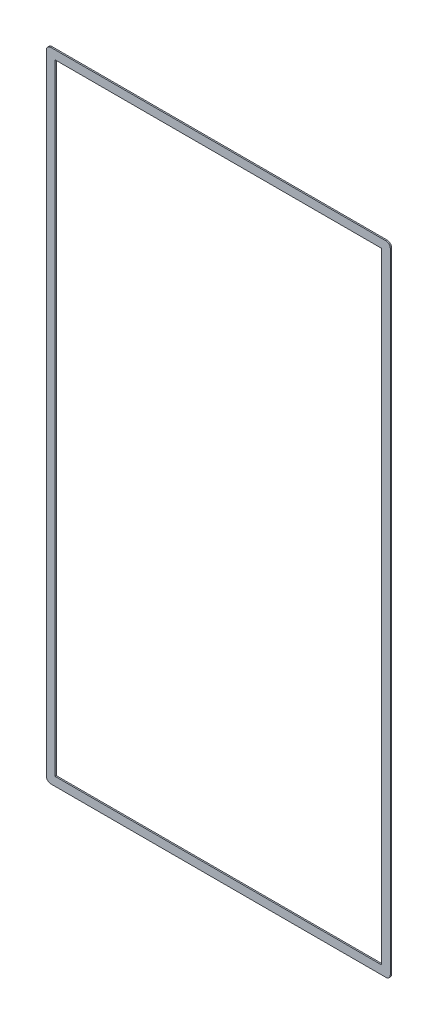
SolidWorks part; units mm, degrees
ref_plane "Front Plane" through (0, 0, 0) normal (0, 0, 1) x (1, 0, 0)
ref_plane "Top Plane" through (0, 0, 0) normal (0, 1, 0) x (1, 0, 0)
ref_plane "Right Plane" through (0, 0, 0) normal (1, 0, 0) x (0, 0, -1)
sketch "Sketch1" plane through (0, 0, 0) normal (0, 0, 1) x (1, 0, 0)
  line L0 (-251.968, 461.137) -> (-251.968, -461.137)
  line L1 (-245.618, -467.487) -> (245.618, -467.487)
  line L2 (251.968, -461.137) -> (251.968, 461.137)
  line L3 (245.618, 467.487) -> (-245.618, 467.487)
  arc A0 (-245.618, 467.487) -> (-251.968, 461.137) centre (-245.618, 461.137) ccw
  arc A1 (-251.968, -461.137) -> (-245.618, -467.487) centre (-245.618, -461.137) ccw
  arc A2 (245.618, -467.487) -> (251.968, -461.137) centre (245.618, -461.137) ccw
  arc A3 (251.968, 461.137) -> (245.618, 467.487) centre (245.618, 461.137) ccw
  point P13 (0, 467.487)
  point P14 (251.968, 0)
  dimension "D1" = 6.35
  dimension "D3" = 934.974
  dimension "D4" = 503.936
extrude "Boss-Extrude1" add sketch "Sketch1" along normal blind 1.905
shell "Shell1" thickness 12.7
